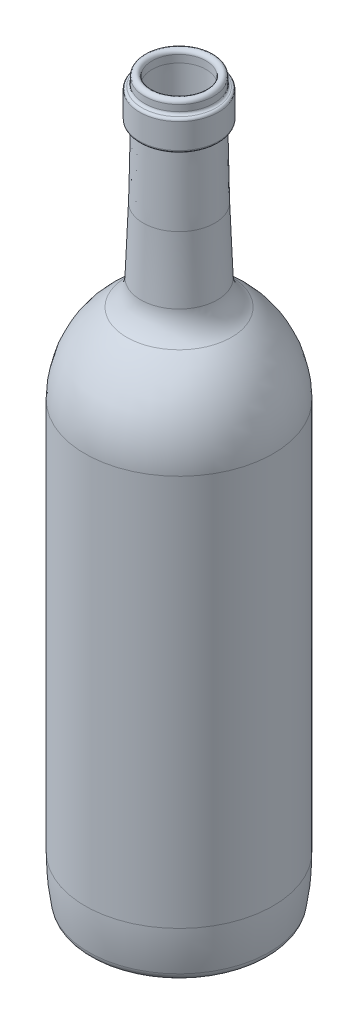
SolidWorks part; units mm, degrees
ref_plane "Přední rovina" through (0, 0, 0) normal (0, 0, 1) x (1, 0, 0)
ref_plane "Horní rovina" through (0, 0, 0) normal (0, 1, 0) x (1, 0, 0)
ref_plane "Pravá rovina" through (0, 0, 0) normal (1, 0, 0) x (0, 0, -1)
sketch "Skica1" plane through (0, 0, 0) normal (0, 0, 1) x (1, 0, 0)
  line L0 (0, 0) -> (0, 289) construction
  line L1 (-8.4776, 6.7773) -> (-30.9296, 0.163)
  line L2 (-37.45, 176) -> (-37.45, 20)
  line L3 (0, 8) -> (-3.8605, 8) construction
  line L4 (0, 0) -> (-46.7512, 0) construction
  line L5 (-14.25, 244) -> (-13.75, 271)
  line L6 (-15.75, 273.0183) -> (-15.75, 283.0183)
  line L7 (-13.75, 285.0183) -> (-13.75, 287.5)
  line L8 (-13.75, 271) -> (-13.75, 285.0183) construction
  line L9 (-14.75, 284.0183) -> (-14.75, 272.0185) construction
  line L10 (0, 289) -> (-15.9004, 289) construction
  line L11 (-13.75, 287.5) -> (-10.75, 287.5) construction
  line L12 (-9.3254, 9.655) -> (-31.7773, 3.0408)
  line L13 (-34.45, 176) -> (-34.45, 20)
  line L14 (-11.2505, 243.9445) -> (-10.7505, 270.9445)
  line L15 (-10.7837, 284.5002) -> (-10.7505, 270.9445)
  line L16 (0, 11) -> (0, 8)
  line L17 (-10.75, 287.5) -> (-10.7837, 284.5002)
  line L19 (-12.75, 274.4827) -> (-12.75, 281.5542) construction
  line L20 (-10.7837, 284.5002) -> (-10.7837, 284.5002) construction
  arc A0 (-37.45, 20) -> (-36, 3.3102) centre (59.3268, 20) ccw
  arc A1 (-36, 3.3102) -> (-30.9296, 0.163) centre (-32.0599, 4) ccw
  arc A2 (-8.4776, 6.7773) -> (0, 8) centre (0, -22) cw
  arc A3 (-37.45, 176) -> (-20.8717, 207.9103) centre (1.55, 176) cw
  arc A4 (-20.8717, 207.9103) -> (-15.25, 218) centre (-28.5054, 218.7746) ccw
  arc A5 (-15.25, 218) -> (-14.25, 244) centre (-667.0714, 256.0893) ccw
  arc A6 (-13.75, 271) -> (-14.75, 272.0185) centre (-14.7498, 271.0185) ccw
  arc A7 (-14.75, 272.0185) -> (-15.75, 273.0183) centre (-14.7502, 273.0183) cw
  arc A8 (-15.75, 283.0183) -> (-14.75, 284.0183) centre (-14.75, 283.0183) cw
  arc A9 (-14.75, 284.0183) -> (-13.75, 285.0183) centre (-14.75, 285.0183) ccw
  arc A10 (-13.75, 287.5) -> (-10.75, 287.5) centre (-12.25, 287.5) cw
  arc A11 (-9.3254, 9.655) -> (0, 11) centre (0, -22) cw
  arc A12 (-33.0449, 3.8275) -> (-31.7773, 3.0408) centre (-32.0599, 4) ccw
  arc A13 (-34.45, 20) -> (-33.0449, 3.8275) centre (59.3268, 20) ccw
  arc A14 (-34.45, 176) -> (-19.1469, 205.4557) centre (1.55, 176) cw
  arc A15 (-19.1469, 205.4557) -> (-12.2551, 217.825) centre (-28.5054, 218.7746) ccw
  arc A16 (-12.2551, 217.825) -> (-11.2505, 243.9445) centre (-667.0714, 256.0893) ccw
  arc A22 (-12.75, 281.5542) -> (-10.7837, 284.5002) centre (-14.75, 285.0183) ccw construction
  arc A23 (-12.75, 281.5542) -> (-12.75, 281.5542) centre (-12.75, 281.5542) cw construction
  arc A24 (-12.75, 274.4827) -> (-12.75, 274.4827) centre (-12.75, 274.4827) cw construction
  arc A25 (-10.7837, 284.5002) -> (-10.7837, 284.5002) centre (-10.7837, 284.5002) ccw construction
  arc A26 (-10.7505, 270.9445) -> (-12.75, 274.4827) centre (-14.7498, 271.0185) ccw construction
  dimension "D1" = 4
  dimension "D6" = 30
  dimension "D8" = 39
  dimension "D9" = 14.25
  dimension "D17" = 1
  dimension "D18" = 1
  dimension "D22" = 289
  dimension "D2" = 20
  dimension "D3" = 37.45
  dimension "D4" = 36
  dimension "D5" = 8
  dimension "D7" = 176
  dimension "D10" = 15.25
  dimension "D11" = 218
  dimension "D12" = 13.75
  dimension "D13" = 45
  dimension "D14" = 18
  dimension "D15" = 2
  dimension "D16" = 1
  dimension "D19" = 10
  dimension "D20" = 3
  dimension "D21" = 3
revolve "Rotovat1" add sketch "Skica1" angle 360 about L0
